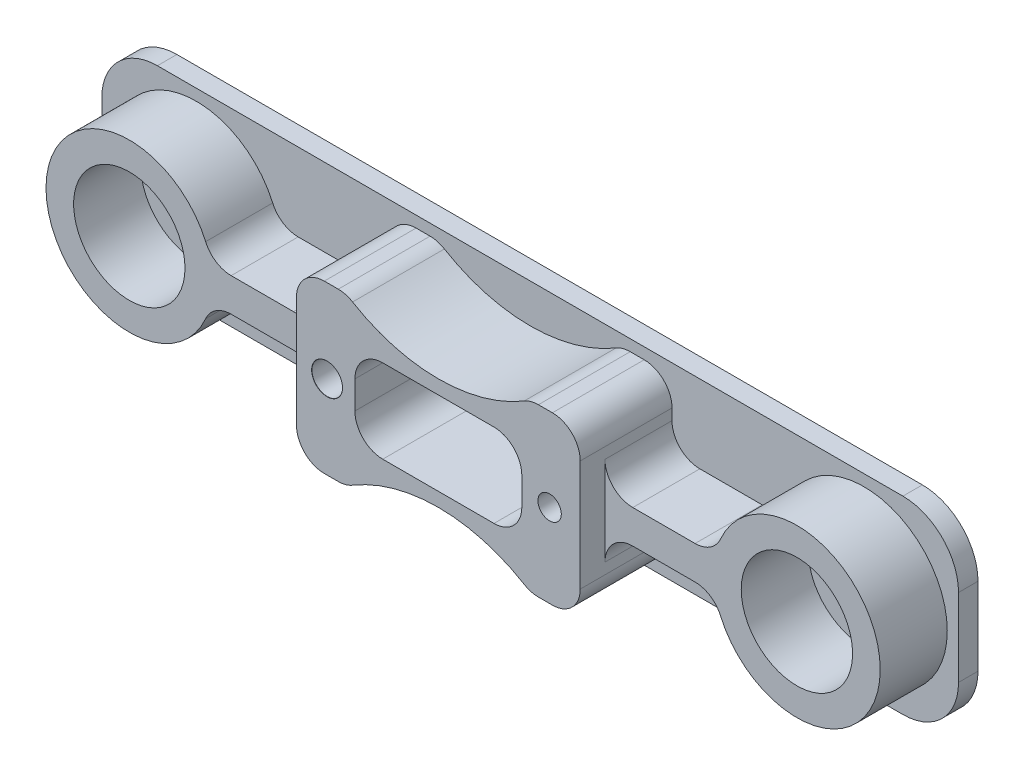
SolidWorks part; units mm, degrees
ref_plane "Vorne" through (0, 0, 0) normal (0, 0, 1) x (1, 0, 0)
ref_plane "Oben" through (0, 0, 0) normal (0, 1, 0) x (1, 0, 0)
ref_plane "Rechts" through (0, 0, 0) normal (1, 0, 0) x (0, 0, -1)
sketch "Skizze1" plane through (0, 0, 0) normal (0, 0, 1) x (1, 0, 0)
  line L1 (67, -17) -> (-67, -17)
  line L2 (77, -7) -> (77, 7)
  line L3 (67, 17) -> (-67, 17)
  line L4 (-77, -7) -> (-77, 7)
  line L5 (77, -17) -> (-77, 17) construction
  line L6 (77, 17) -> (-77, -17) construction
  arc A0 (67, -17) -> (77, -7) centre (67, -7) ccw
  arc A1 (77, 7) -> (67, 17) centre (67, 7) ccw
  arc A2 (-67, -17) -> (-77, -7) centre (-67, -7) cw
  arc A3 (-67, 17) -> (-77, 7) centre (-67, 7) ccw
  point P0 (0, 0)
  dimension "D3" = 10
  dimension "D1" = 34
  dimension "D2" = 154
extrude "Aufsatz-Linear austragen1" add sketch "Skizze1" along normal blind 3.5
sketch "Skizze2" plane through (0, 0, 3.5) normal (0, 0, 1) x (1, 0, 0)
  line L1 (-10, 7.5) -> (10, 7.5)
  line L2 (-15, 2.5) -> (-15, -2.5)
  line L3 (-10, -7.5) -> (10, -7.5)
  line L4 (15, 2.5) -> (15, -2.5)
  line L5 (-15, 7.5) -> (15, -7.5) construction
  line L6 (-15, -7.5) -> (15, 7.5) construction
  line L7 (-20.5, -14.975) -> (20.5, -14.975)
  line L8 (-25.5, -9.975) -> (-25.5, 9.975)
  line L9 (-20.5, 14.975) -> (20.5, 14.975)
  line L10 (25.5, -9.975) -> (25.5, 9.975)
  line L11 (-25.5, -14.975) -> (25.5, 14.975) construction
  line L12 (-25.5, 14.975) -> (25.5, -14.975) construction
  arc A0 (10, -7.5) -> (15, -2.5) centre (10, -2.5) ccw
  arc A1 (-15, -2.5) -> (-10, -7.5) centre (-10, -2.5) ccw
  arc A2 (-10, 7.5) -> (-15, 2.5) centre (-10, 2.5) ccw
  arc A3 (10, 7.5) -> (15, 2.5) centre (10, 2.5) cw
  arc A4 (-20.5, -14.975) -> (-25.5, -9.975) centre (-20.5, -9.975) cw
  arc A5 (20.5, -14.975) -> (25.5, -9.975) centre (20.5, -9.975) ccw
  arc A6 (20.5, 14.975) -> (25.5, 9.975) centre (20.5, 9.975) cw
  arc A7 (-25.5, 9.975) -> (-20.5, 14.975) centre (-20.5, 9.975) cw
  point P0 (0, 0)
  point P6 (0, 0)
  dimension "D5" = 5
  dimension "D1" = 51
  dimension "D2" = 30
  dimension "D4" = 15
extrude "Aufsatz-Linear austragen2" add sketch "Skizze2" along normal blind 16.5
sketch "Skizze3" plane through (0, 0, 20) normal (0, 0, 1) x (1, 0, 0)
  line L0 (-25.5, 0) -> (25.5, 0) construction
  line L1 (-25.5, 9.975) -> (-25.5, -9.975) construction
  line L2 (25.5, -9.975) -> (25.5, 9.975) construction
  line L4 (0, 40) -> (0, -40) construction
  circle A0 centre (0, -40) radius 30
  circle A1 centre (0, 40) radius 30
  dimension "D1" = 60
  dimension "D2" = 40
extrude "Schnitt-Linear austragen2" cut sketch "Skizze3" against normal up to surface (16.5 mm away)
fillet "Verrundung1" radius 5 4 edges at (16.5454, -14.975, 11.75) (-16.5454, -14.975, 11.75) (-16.5454, 14.975, 11.75) (16.5454, 14.975, 11.75)
sketch "Skizze4" plane through (0, 0, 3.5) normal (0, 0, 1) x (1, 0, 0)
  line L0 (0, 17) -> (0, -17) construction
  line L1 (67, 17) -> (-67, 17) construction
  line L2 (-67, -17) -> (67, -17) construction
  line L3 (-25.5, 0) -> (-60, 0) construction
  line L4 (-25.5, 0) -> (0, 0) construction
  line L5 (25.5, 0) -> (0, 0) construction
  line L6 (-25.5, 3) -> (-45.3286, 3)
  line L7 (25.5, 0) -> (60, 0) construction
  line L8 (-25.5, -3) -> (-45.3286, -3)
  line L9 (-25.5, 3) -> (-25.5, -3)
  line L10 (-25.5, 9.975) -> (-25.5, -9.975) construction
  line L11 (25.5, 3) -> (25.5, -3)
  line L12 (-25.5, 3) -> (-60, 3) construction
  line L13 (-25.5, -3) -> (-60, -3) construction
  line L14 (25.5, -3) -> (45.3286, -3)
  line L15 (-25.5, -3) -> (0, -3) construction
  line L16 (-25.5, 3) -> (0, 3) construction
  line L17 (25.5, 3) -> (45.3286, 3)
  arc A0 (-45.3286, 3) -> (-45.3286, -3) centre (-60, 0) ccw
  circle A1 centre (-60, 0) radius 10.0082
  circle A2 centre (60, 0) radius 10.0082
  arc A3 (45.3286, 3) -> (45.3286, -3) centre (60, 0) cw
  dimension "D2" = 20.0165
  dimension "D3" = 120
  dimension "D4" = 3
  dimension "D5" = 3
extrude "Aufsatz-Linear austragen3" add sketch "Skizze4" along normal blind 12.05
fillet "Verrundung2" radius 5 8 edges at (45.3286, -3, 9.525) (25.5, -3, 9.525) (-45.3286, -3, 9.525) (-25.5, -3, 9.525) (-25.5, 3, 9.525) (45.3286, 3, 9.525) (25.5, 3, 9.525) (-45.3286, 3, 9.525)
hole_wizard "Formsenkung für M5 Senkschraube mit Innensechskant1" positions "Skizze6" profile "Skizze5" countersink size "M5" standard "DIN"
sketch "Skizze6" plane through (0, 0, 0) normal (0, 0, -1) x (-1, 0, 0)
  point P0 (20, 0)
  dimension "D1" = 20
sketch "Skizze5" plane through (-20, 0, 0) normal (1, 0, 0) x (0, 1, 0)
  line L0 (0, 0) -> (0, 20)
  line L1 (0, 20) -> (2.775, 20)
  line L3 (2.75, 2.95) -> (5.2, 0.5)
  line L4 (5.2, 0.5) -> (5.2, 0)
  line L6 (5.2, 0) -> (0, 0)
  line L7 (-2.75, 2.95) -> (-5.2, 0.5) construction
  line L8 (2.775, 20) -> (2.75, 19.975)
  line L9 (2.75, 19.975) -> (2.75, 2.95)
  line L10 (-2.775, 20) -> (-2.75, 19.975) construction
  line L11 (0, -6.35) -> (0, 107.95) construction
  dimension "Bohrerdurchmesser" = 5.5
  dimension "Bohrungstiefe" = 20
  dimension "Senkdurchmesser2" = 10.4
  dimension "Senkwinkel2" = 90
  dimension "Senkdurchmesser2 (Unten)" = 5.55
  dimension "Senkwinkel2 (Unten)" = 90
  dimension "Kopfspielraum" = 0.5
hole_wizard "M5 Gewindebohrung1" positions "Skizze8" profile "Skizze7" tap size "M5" standard "DIN"
sketch "Skizze8" plane through (0, 0, 20) normal (0, 0, 1) x (1, 0, 0)
  point P0 (20, 0)
  dimension "D1" = 20
sketch "Skizze7" plane through (20, 0, 20) normal (1, 0, 0) x (0, -1, 0)
  line L0 (0, 0) -> (0, 18.2618)
  line L1 (0, 18.2618) -> (2.1, 17)
  line L2 (2.1, 17) -> (2.1, 0)
  line L5 (2.1, 0) -> (0, 0)
  line L10 (0, 18.2618) -> (-2.1, 17) construction
  line L11 (0, -6.35) -> (0, 107.95) construction
  dimension "Bohrerdurchmesser" = 4.2
  dimension "Bohrungstiefe" = 17
  dimension "Spitzenwinkel" = 118
